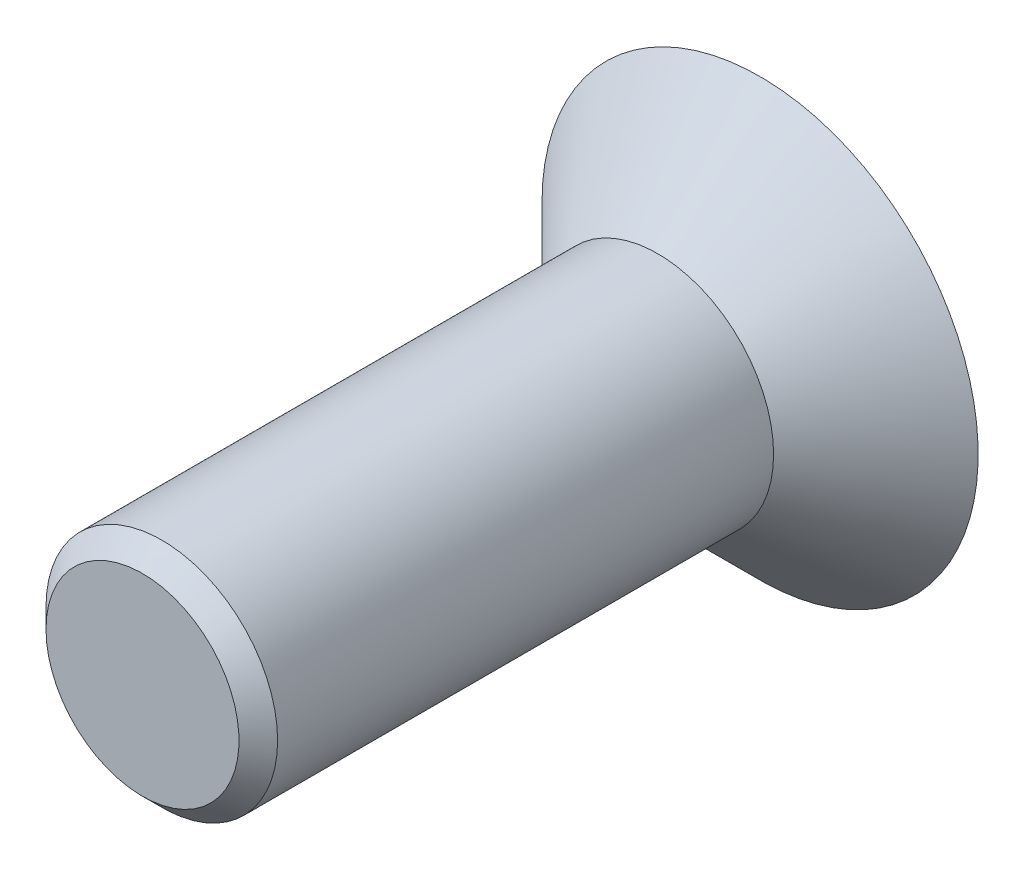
SolidWorks part; units mm, degrees
ref_plane "Plan1" through (0, 0, 0) normal (0, 0, 1) x (1, 0, 0)
ref_plane "Plan2" through (0, 0, 0) normal (0, 1, 0) x (1, 0, 0)
ref_plane "Plan3" through (0, 0, 0) normal (1, 0, 0) x (0, 0, -1)
sketch "profil tête" plane through (0, 0, 0) normal (0, 0, 1) x (1, 0, 0)
  circle A0 centre (0, 0) radius 5.65
  dimension "DIAMETRE" = 11.3
extrude "TETE" add sketch "profil tête" along normal blind 2.65
sketch "profil fraisage" plane through (0, 0, 0) normal (1, 0, 0) x (0, 0, -1)
  line L0 (-0.2723, 0) -> (-1.4121, 0) construction
  line L1 (-2.65, 0) -> (0, 0) construction
  line L2 (0, -5.65) -> (0, 5.65) construction
  line L3 (0, 5.65) -> (-2.65, 3)
  line L7 (-2.65, 3) -> (-2.65, 5.65)
  line L8 (-2.65, 5.65) -> (0, 5.65)
  line L13 (-2.65, 5.65) -> (-2.65, -5.65) construction
  dimension "D1" = 45
  dimension "PIED" = 6
revolve "FRAISAGE" cut sketch "profil fraisage" angle 360 about L0
sketch "profil six pans" plane through (0, 0, 0) normal (0, 0, -1) x (-1, 0, 0)
  line L0 (0, -2.3094) -> (0, 2.3094) construction
  line L1 (-2, 1.1547) -> (-2, -1.1547)
  line L2 (2, 1.1547) -> (2, -1.1547)
  line L3 (-2, 1.1547) -> (0, 2.3094)
  line L4 (2, 1.1547) -> (0, 2.3094)
  line L5 (-2, -1.1547) -> (0, -2.3094)
  line L6 (2, -1.1547) -> (0, -2.3094)
  line L7 (-2, -1.1547) -> (2, 1.1547) construction
  line L8 (-2, 1.1547) -> (2, -1.1547) construction
  point P0 (0, 0)
  dimension "D1" = 60
  dimension "LARGEUR" = 4
extrude "SIX PANS" cut sketch "profil six pans" against normal blind 1.6562
sketch "profil cylindre" plane through (0, 0, 2.65) normal (0, 0, 1) x (1, 0, 0)
  circle A0 centre (0, 0) radius 3
  dimension "DIAMETRE" = 6
extrude "CYLINDRE FILETE" add sketch "profil cylindre" along normal blind 13.35
revolve "CHANFREIN FILET" cut sketch "profil chanfrein" angle 360 about L4
sketch "profil chanfrein" plane through (0, 0, 0) normal (1, 0, 0) x (0, 0, -1)
  line L0 (-16, 2.5) -> (-15.5, 3)
  line L1 (-16, 3) -> (-16, -3) construction
  line L2 (-16, 3) -> (-15.5, 3)
  line L4 (-12.0874, 0) -> (-18.1046, 0) construction
  line L5 (-16, 0) -> (-2.65, 0) construction
  line L6 (-2.65, 3) -> (-16, 3) construction
  line L8 (-16, 3) -> (-16, 2.5)
  dimension "D1" = 45
  dimension "D2" = 5
